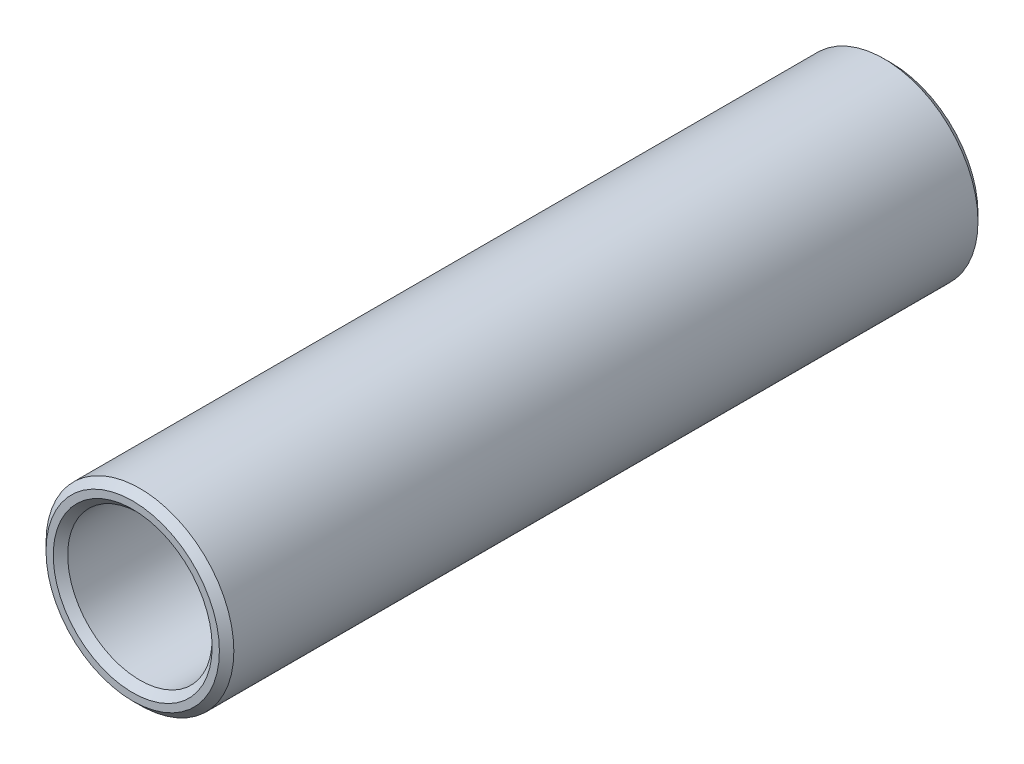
SolidWorks part; units mm, degrees
ref_plane "Plan de face" through (0, 0, 0) normal (0, 0, 1) x (1, 0, 0)
ref_plane "Plan de dessus" through (0, 0, 0) normal (0, 1, 0) x (1, 0, 0)
ref_plane "Plan de droite" through (0, 0, 0) normal (1, 0, 0) x (0, 0, -1)
sketch "Esquisse1" plane through (0, 0, 0) normal (0, 0, 1) x (1, 0, 0)
  circle A0 centre (0, 0) radius 13
  circle A1 centre (0, 0) radius 10
  dimension "D1" = 26
  dimension "D2" = 20
extrude "Extrusion1" add sketch "Esquisse1" along normal blind 105
chamfer "Chanfrein1" distance 1 angle 45 4 edges at (10, 0, 105) (13, 0, 105) (10, 0, 0) (13, 0, 0)
